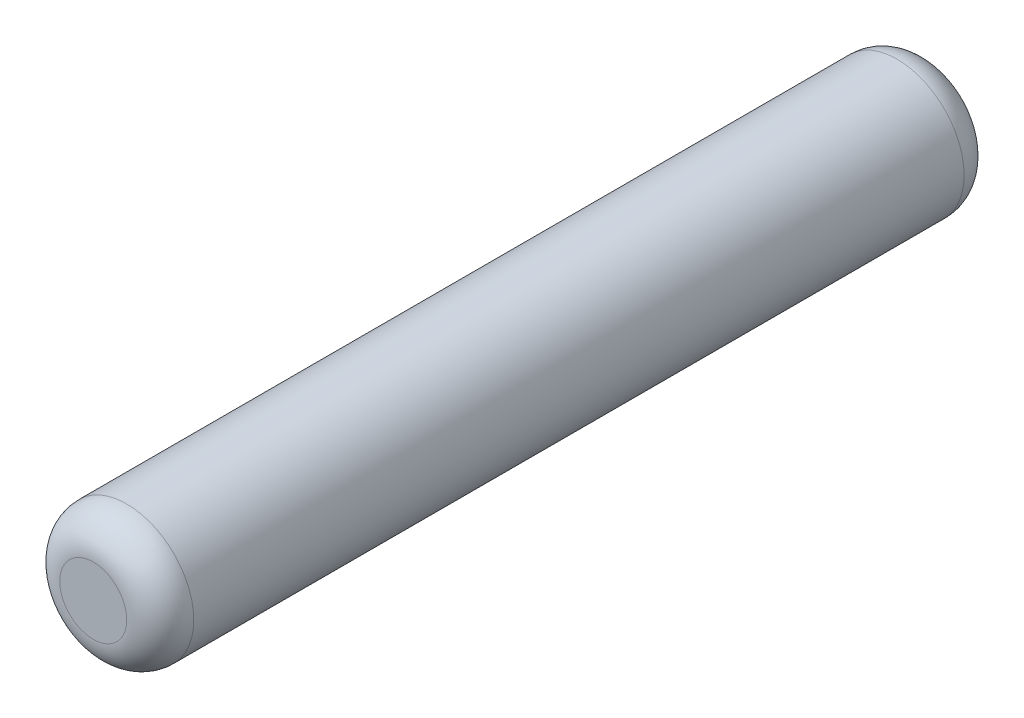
SolidWorks part; units mm, degrees
ref_plane "前视基准面" through (0, 0, 0) normal (0, 0, 1) x (1, 0, 0)
ref_plane "上视基准面" through (0, 0, 0) normal (0, 1, 0) x (1, 0, 0)
ref_plane "右视基准面" through (0, 0, 0) normal (1, 0, 0) x (0, 0, -1)
sketch "草图1" plane through (0, 0, 0) normal (0, 0, 1) x (1, 0, 0)
  circle A0 centre (0, 0) radius 2
  dimension "D1" = 4
extrude "凸台-拉伸1" add sketch "草图1" along normal mid plane 25
fillet "圆角1" radius 1 2 edges at (2, 0, -12.5) (2, 0, 12.5)
